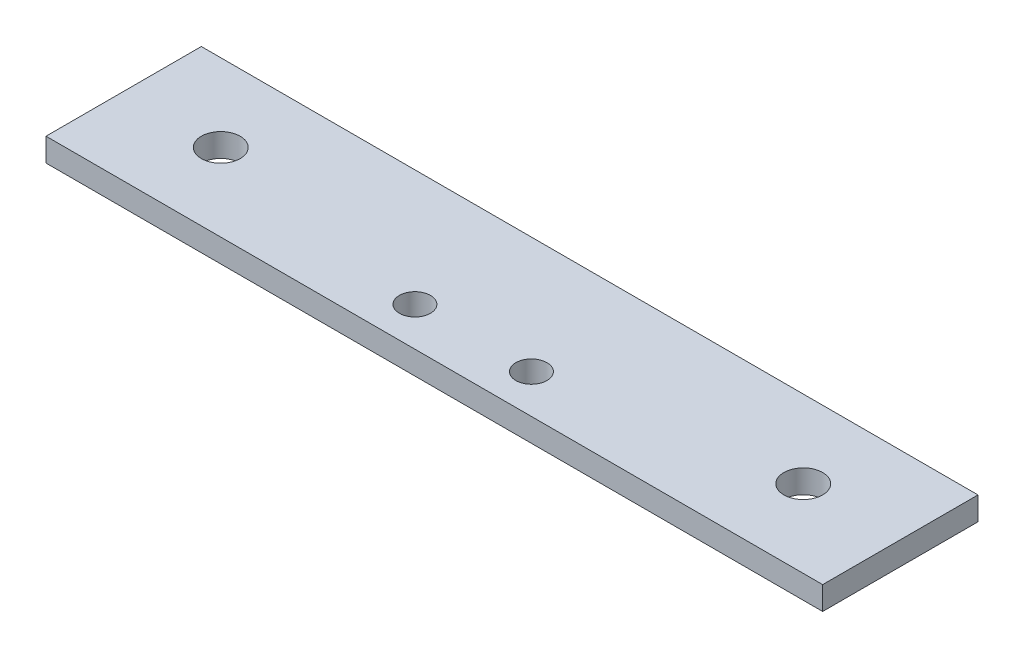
SolidWorks part; units mm, degrees
ref_plane "Front Plane" through (0, 0, 0) normal (0, 0, 1) x (1, 0, 0)
ref_plane "Top Plane" through (0, 0, 0) normal (0, 1, 0) x (1, 0, 0)
ref_plane "Right Plane" through (0, 0, 0) normal (1, 0, 0) x (0, 0, -1)
sketch "Sketch1" plane through (0, 0, 0) normal (0, 1, 0) x (1, 0, 0)
  line L1 (-50, 10) -> (50, 10)
  line L2 (-50, 10) -> (-50, -10)
  line L3 (-50, -10) -> (50, -10)
  line L4 (50, 10) -> (50, -10)
  line L5 (-50, 10) -> (50, -10) construction
  line L6 (-50, -10) -> (50, 10) construction
  circle A0 centre (-37.5, 0) radius 2.5
  circle A1 centre (37.5, 0) radius 2.5
  circle A2 centre (-7.5, -5) radius 2
  circle A3 centre (7.5, -5) radius 2
  point P0 (0, 0)
  dimension "D5" = 5
  dimension "D6" = 5
  dimension "D7" = 10
  dimension "D8" = 10
  dimension "D9" = 4
  dimension "D10" = 4
  dimension "D11" = 5
  dimension "D12" = 5
  dimension "D13" = 15
  dimension "D14" = 42.5
  dimension "D1" = 100
  dimension "D2" = 20
  dimension "D3" = 75
  dimension "D4" = 12.5
extrude "Boss-Extrude1" add sketch "Sketch1" along normal blind 3
